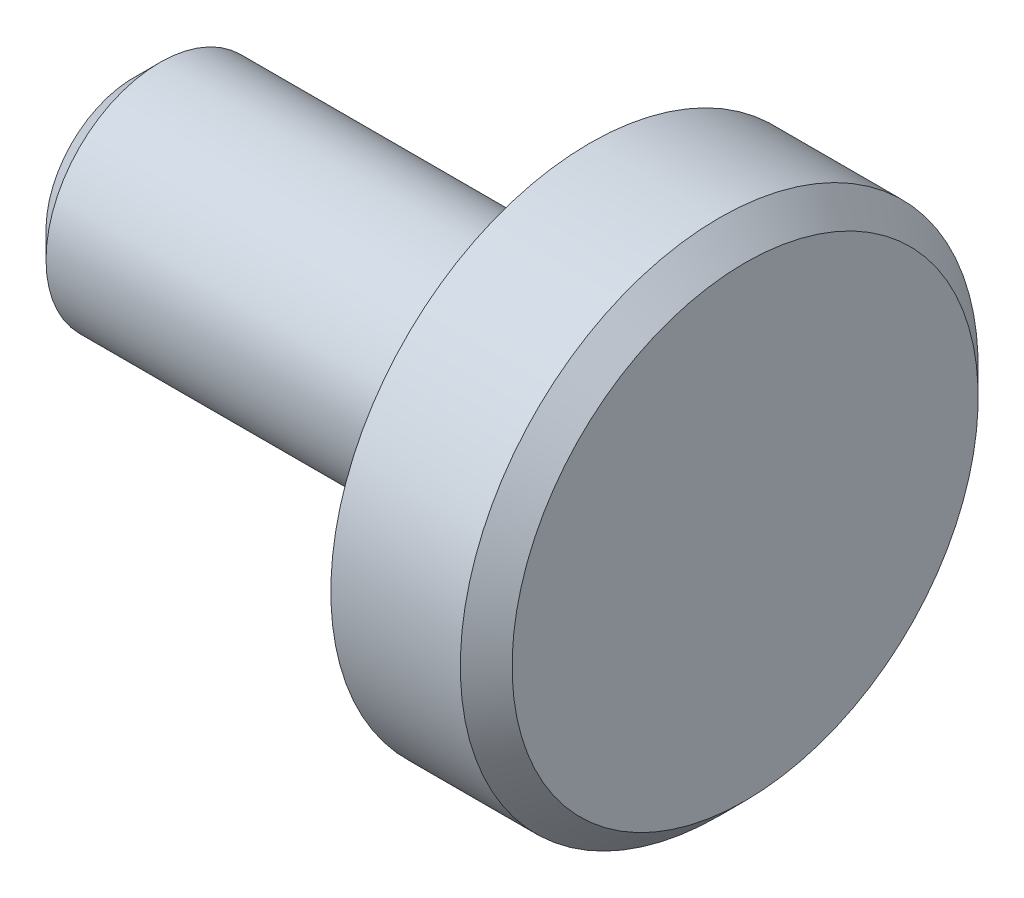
SolidWorks part; units mm, degrees
ref_plane "Front Plane" through (0, 0, 0) normal (0, 0, 1) x (1, 0, 0)
ref_plane "Top Plane" through (0, 0, 0) normal (0, 1, 0) x (1, 0, 0)
ref_plane "Right Plane" through (0, 0, 0) normal (1, 0, 0) x (0, 0, -1)
sketch "Sketch1" plane through (0, 0, 0) normal (0, 0, 1) x (1, 0, 0)
  line L0 (0, 0) -> (-14.986, 0)
  line L1 (-14.986, 0) -> (-14.986, 2.794)
  line L2 (-14.986, 2.794) -> (-3.81, 2.794)
  line L3 (-3.81, 2.794) -> (-3.81, 6.35)
  line L4 (-3.81, 6.35) -> (0, 6.35)
  line L5 (0, 6.35) -> (0, 0)
  line L6 (0, 0) -> (-20.4551, 0) construction
  dimension "D1" = 6.35
  dimension "D2" = 2.794
  dimension "D3" = 14.986
  dimension "D4" = 3.81
revolve "Revolve1" add sketch "Sketch1" angle 360 about L6
chamfer "Chamfer1" distance 0.635 angle 45 2 edges at (0, 6.35, 0) (-14.986, 2.794, 0)
